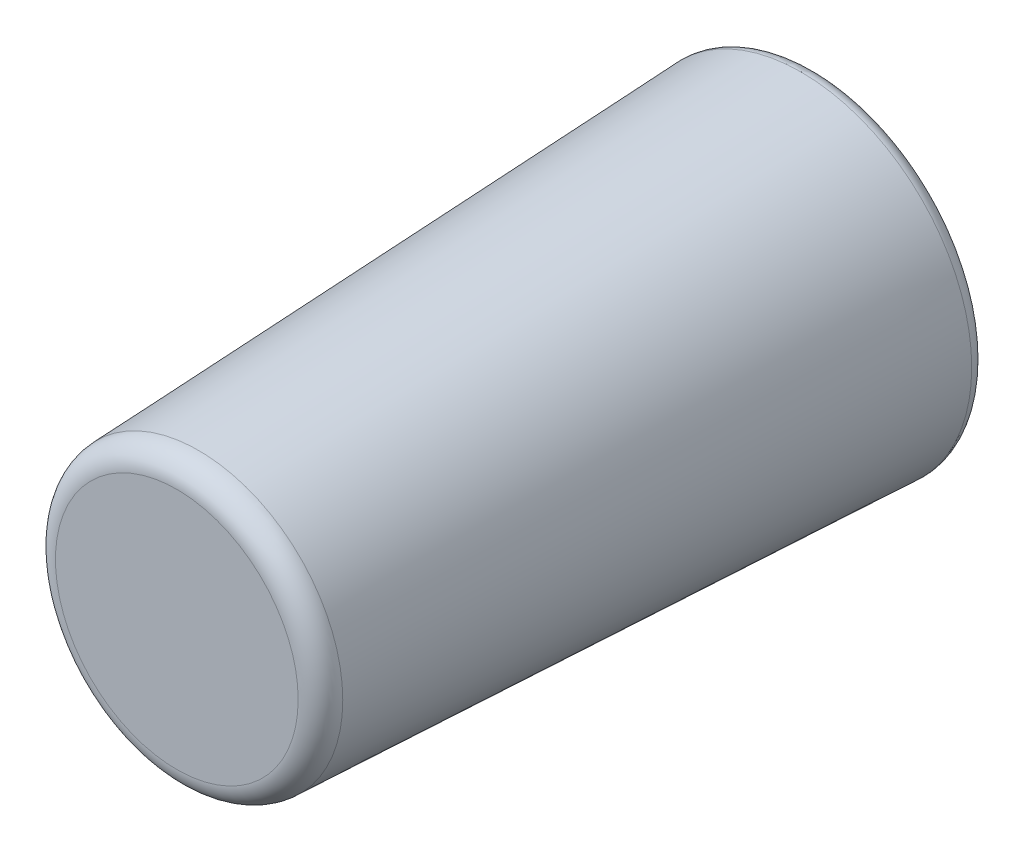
SolidWorks part; units mm, degrees
ref_plane "Front" through (0, 0, 0) normal (0, 0, 1) x (1, 0, 0)
ref_plane "Top" through (0, 0, 0) normal (0, 1, 0) x (1, 0, 0)
ref_plane "Right" through (0, 0, 0) normal (1, 0, 0) x (0, 0, -1)
sketch "Sketch1" plane through (0, 0, 0) normal (0, 0, 1) x (1, 0, 0)
  circle A0 centre (0, 0) radius 9.525
  dimension "D1" = 19.05
extrude "Base-Extrude" add sketch "Sketch1" along normal blind 35.56 draft 2.5
fillet "Fillet1" radius 1.27
sketch "Sketch2" plane through (0, 0, 0) normal (0, 0, -1) x (-1, 0, 0)
  circle A0 centre (0, 0) radius 7.3025
  dimension "D1" = 14.605
extrude "Cut-Extrude1" cut sketch "Sketch2" against normal blind 4.445
shell "Shell1" thickness 1.016
fillet "Fillet2" radius 0.762
